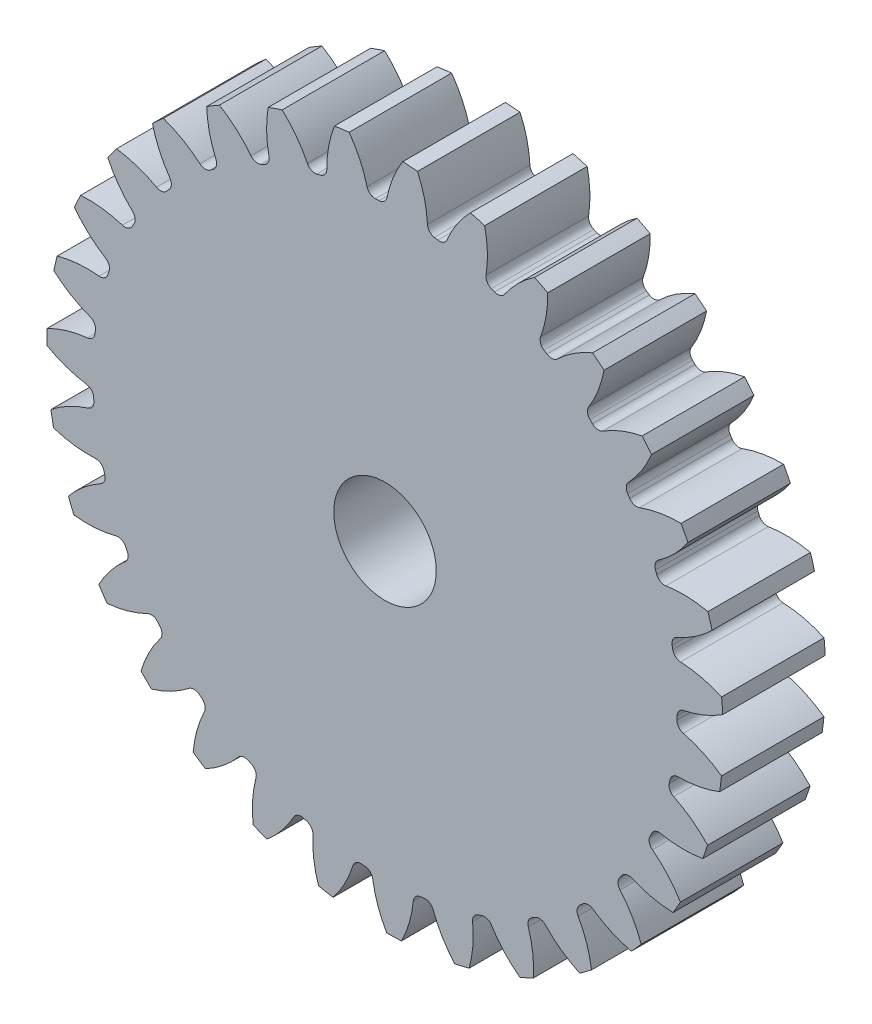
SolidWorks part; units mm, degrees
ref_plane "Front" through (0, 0, 0) normal (0, 0, 1) x (1, 0, 0)
ref_plane "Top" through (0, 0, 0) normal (0, 1, 0) x (1, 0, 0)
ref_plane "Right" through (0, 0, 0) normal (1, 0, 0) x (0, 0, -1)
sketch "Sketch3" plane through (0, 0, 0) normal (0, 0, 1) x (1, 0, 0)
  circle A0 centre (0, 0) radius 335.28
  dimension "od" = 670.56
extrude "gearBody" add sketch "Sketch3" along normal blind 101.6
sketch "Sketch2" plane through (0, 0, 0) normal (0, 0, 1) x (1, 0, 0)
  line L0 (0, 0) -> (273.4365, 113.2611) construction
  line L1 (333.9931, -34.9528) -> (0, 0) construction
  line L2 (0, 0) -> (36.3143, 0) construction
  line L3 (314.8482, 8.3906) -> (314.0898, -23.3968) construction
  line L5 (314.469, -7.5031) -> (0, 0) construction
  line L7 (0, 0) -> (295.9656, 0) construction
  arc A0 (295.9525, 2.7814) -> (295.4831, -16.8928) centre (0, 0) ccw construction
  arc A1 (334.7611, 18.6459) -> (333.4909, -34.5901) centre (0, 0) ccw construction
  arc A2 (314.8482, 8.3906) -> (314.0898, -23.3968) centre (0, 0) ccw construction
  arc A3 (289.43, -8.6745) -> (289.5144, -5.1388) centre (0, 0) ccw
  arc A4 (333.9931, -34.9528) -> (295.6483, -16.9349) centre (267.7237, -126.173) ccw
  arc A5 (333.9931, -34.9528) -> (335.28, 18.9842) centre (0, 0) ccw
  arc A6 (335.28, 18.9842) -> (296.1195, 2.8155) centre (273.4365, 113.2611) cw
  arc A7 (289.5144, -5.1388) -> (296.1195, 2.8155) centre (297.7833, -5.2856) cw
  arc A8 (295.6483, -16.9349) -> (289.43, -8.6745) centre (297.6966, -8.9223) cw
  point P6 (335.28, 18.9842)
  point P22 (333.9931, -34.9528)
  dimension "baseDia" = 591.9312
  dimension "od" = 670.56
  dimension "pd" = 629.92
  dimension "rd" = 579.12
  dimension "rFillet" = 8.2702
  dimension "pointX" = 335.28
  dimension "pointY" = 18.9842
  dimension "CTT" = 31.7875
  dimension "flankCenterAngle" = 22.5
extrude "toothCut" cut sketch "Sketch2" along normal through all
pattern_circular "CirPattern1" count 31 over 360 about axis through (0, 0, 0) along (0, 0, 1) of "toothCut"
sketch "hub1Dia" plane through (0, 0, 0) normal (0, 0, -1) x (-1, 0, 0)
  circle A0 centre (0, 0) radius 12.7
  dimension "hub1Dia" = 25.4
sketch "hub2Dia" plane through (0, 0, 101.6) normal (0, 0, 1) x (1, 0, 0)
  circle A0 centre (0, 0) radius 12.7
  dimension "hub2dia" = 25.4
sketch "boreDia" plane through (0, 0, 0) normal (0, 0, 1) x (1, 0, 0)
  circle A0 centre (0, 0) radius 50.8
  dimension "boreDia" = 101.6
extrude "bore" cut sketch "boreDia" against normal mid plane 25400
